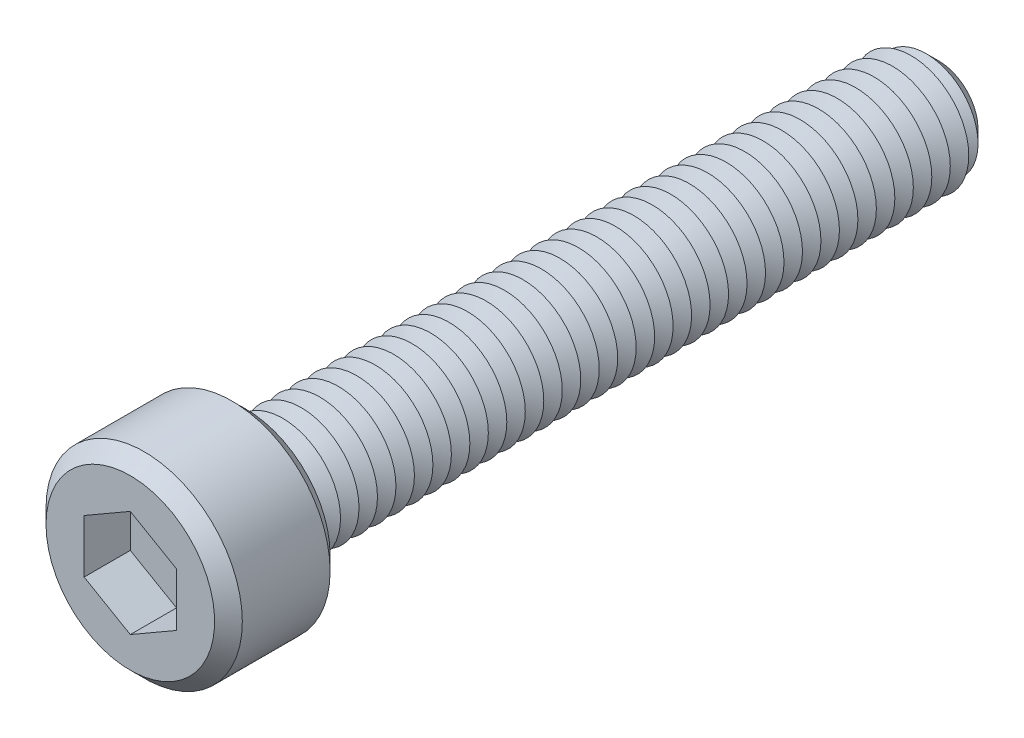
SolidWorks part; units mm, degrees
ref_plane "Front Plane" through (0, 0, 0) normal (0, 0, 1) x (1, 0, 0)
ref_plane "Top Plane" through (0, 0, 0) normal (0, 1, 0) x (1, 0, 0)
ref_plane "Right Plane" through (0, 0, 0) normal (1, 0, 0) x (0, 0, -1)
sketch "Sketch1" plane through (0, 0, 0) normal (0, 0, 1) x (1, 0, 0)
  circle A0 centre (0, 0) radius 4.25
  dimension "D1" = 8.5
extrude "Boss-Extrude1" add sketch "Sketch1" along normal blind 5
sketch "Sketch2" plane through (0, 0, 0) normal (0, 0, -1) x (-1, 0, 0)
  circle A0 centre (0, 0) radius 2.5
  dimension "D1" = 5
extrude "Boss-Extrude2" add sketch "Sketch2" along normal blind 30
chamfer "Chamfer1" distance 0.8 angle 45 1 edges at (-2.5, 0, -30)
sketch "Sketch3" plane through (0, 0, 0) normal (1, 0, 0) x (0, 0, -1)
  line L0 (-2.5121, 0) -> (4.5776, 0) construction
sketch "Sketch4" plane through (0, 0, 0) normal (1, 0, 0) x (0, 0, -1)
  line L0 (0, 2.5) -> (0.4, 1.8072)
  line L1 (0.4, 1.8072) -> (0.8, 2.5)
  line L2 (29.2, 2.5) -> (0, 2.5) construction
  line L3 (0.8, 2.5) -> (0, 2.5)
  dimension "D1" = 0.8
revolve "Cut-Revolve1" cut sketch "Sketch4" angle 360 about L0
pattern_linear "LPattern1" count 37 spacing 0.8 along (0, 0, -1) of "Cut-Revolve1"
sketch "Sketch5" plane through (0, 0, 5) normal (0, 0, 1) x (1, 0, 0)
  line L1 (0, 2.3094) -> (-2, 1.1547)
  line L2 (-2, 1.1547) -> (-2, -1.1547)
  line L3 (-2, -1.1547) -> (0, -2.3094)
  line L4 (0, -2.3094) -> (2, -1.1547)
  line L5 (2, -1.1547) -> (2, 1.1547)
  line L6 (2, 1.1547) -> (0, 2.3094)
  circle A0 centre (0, 0) radius 2 construction
  dimension "D1" = 4
extrude "Cut-Extrude1" cut sketch "Sketch5" against normal blind 2
sketch "Sketch6" plane through (0, 0, 3) normal (0, 0, 1) x (1, 0, 0)
  circle A0 centre (0, 0) radius 0.65
  dimension "D1" = 1.3
extrude "Cut-Extrude2" cut sketch "Sketch6" against normal up to surface (33 mm away)
chamfer "Chamfer2" distance 0.6 angle 45 2 edges at (4.25, 0, 0) (4.25, 0, 5)
